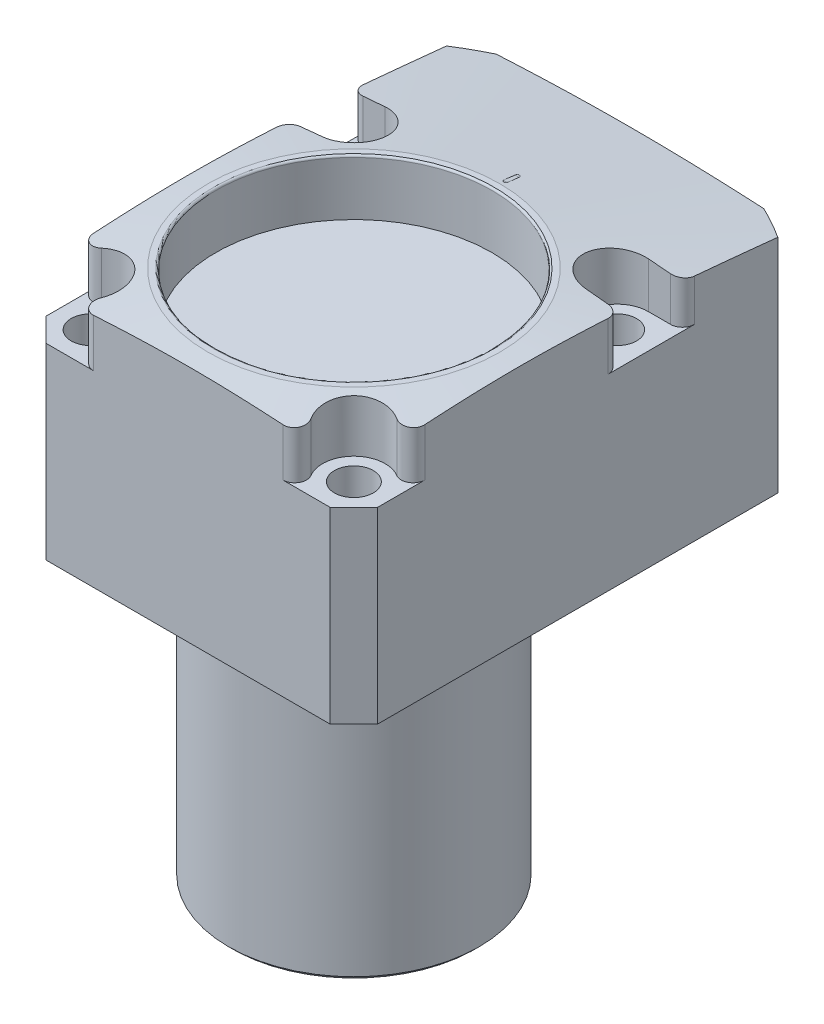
SolidWorks part; units mm, degrees
ref_plane "Front Plane" through (0, 0, 0) normal (0, 0, 1) x (1, 0, 0)
ref_plane "Top Plane" through (0, 0, 0) normal (0, 1, 0) x (1, 0, 0)
ref_plane "Right Plane" through (0, 0, 0) normal (1, 0, 0) x (0, 0, -1)
sketch "Sketch6" plane through (0, 0, 0) normal (0, 0, 1) x (1, 0, 0)
  line L0 (0, -8.9689) -> (0, 71.3762) construction
  line L1 (17.515, 30.5816) -> (18.5, 30.5816)
  line L2 (18.5, 30.5816) -> (38.895, 28.0774)
  line L3 (38.895, 28.0774) -> (38.895, 0)
  line L4 (38.895, 0) -> (15.885, 0)
  line L5 (15.885, 0) -> (15.885, -36.4998)
  line L6 (15.885, -36.4998) -> (0, -36.4998)
  line L7 (0, -36.4998) -> (0, 23.5116)
  line L8 (17.515, 30.5816) -> (17.515, 23.5116)
  line L9 (17.515, 23.5116) -> (0, 23.5116)
  dimension "D1" = 31.77
  dimension "D2" = 30.5816
  dimension "D3" = 36.4998
  dimension "D4" = 77.79
  dimension "D5" = 7
  dimension "D6" = 37
  dimension "D7" = 7.07
  dimension "D8" = 35.03
  dimension "D9" = 67.0814
revolve "Revolve3" add sketch "Sketch6" angle 360 about L0
fillet "Fillet7" radius 0.25 1 edges at (0, 30.5816, -17.515)
sketch "Sketch7" plane through (0, 0, 0) normal (0, -1, 0) x (1, 0, 0)
  line L0 (0, 0) -> (0, -52.3237) construction
  line L1 (-21, 21) -> (21, 21)
  line L2 (-21, 21) -> (-21, -35)
  line L3 (-21, -35) -> (21, -35)
  line L4 (21, 21) -> (21, -35)
  dimension "D1" = 42
  dimension "D2" = 56
  dimension "D3" = 21
extrude "Cut-Extrude5" cut sketch "Sketch7" against normal through all flip side to cut
sketch "Sketch8" plane through (0, 0, 0) normal (0, -1, 0) x (1, 0, 0)
  circle A0 centre (-16.6878, 16.6878) radius 2.4638
  dimension "D1" = 4.9276
  dimension "D2" = 16.6878
  dimension "D3" = 16.6878
extrude "Cut-Extrude6" cut sketch "Sketch8" against normal through all
pattern_circular "CirPattern2" count 4 over 360 about axis through (0, 0, 0) along (0, 1, 0) of "Cut-Extrude6"
chamfer "Chamfer1" distance 3 angle 45 2 edges at (-21, 14.6033, 21) (21, 14.6033, 21)
sketch "Sketch9" plane through (0, 30.5816, 0) normal (0, 1, 0) x (1, 0, 0)
  line L0 (-21, -18) -> (-18, -21) construction
  line L1 (-18, -21) -> (18, -21) construction
  line L2 (21, 20.6566) -> (21, 12.7191)
  line L3 (-21, -18) -> (-18, -21)
  line L4 (21, 12.7191) -> (16.6878, 12.7191)
  line L5 (16.6878, 20.6566) -> (21, 20.6566)
  line L6 (-16.6878, 20.6566) -> (-21, 20.6566)
  line L7 (-21, 32.7387) -> (-21, -18) construction
  line L8 (-21, 12.7191) -> (-16.6878, 12.7191)
  line L9 (-21, 20.6566) -> (-21, 12.7191)
  line L10 (-18, -21) -> (-15.3873, -21)
  line L11 (0, 0) -> (0, 26.6366) construction
  line L13 (-21, -15.3873) -> (-19.4941, -13.8815)
  line L14 (-13.8815, -19.4941) -> (-15.3873, -21)
  line L15 (-21, -15.3873) -> (-21, -18)
  line L16 (21, -15.3873) -> (21, -18)
  line L17 (13.8815, -19.4941) -> (15.3873, -21)
  line L18 (21, -15.3873) -> (19.4941, -13.8815)
  line L19 (18, -21) -> (15.3873, -21)
  line L20 (21, -18) -> (18, -21)
  arc A0 (-13.8815, -19.4941) -> (-19.4941, -13.8815) centre (-16.6878, -16.6878) ccw
  arc A1 (-16.6878, 12.7191) -> (-16.6878, 20.6566) centre (-16.6878, 16.6878) ccw
  arc A2 (13.8815, -19.4941) -> (19.4941, -13.8815) centre (16.6878, -16.6878) cw
  arc A3 (16.6878, 12.7191) -> (16.6878, 20.6566) centre (16.6878, 16.6878) cw
  dimension "D1" = 7.9375
extrude "Cut-Extrude7" cut sketch "Sketch9" against normal offset from surface (6.7818 mm away) 23.7998
fillet "Fillet4" radius 1.5 8 edges at (-21, 26.8192, -12.7191) (21, 26.518, -20.6566) (21, 26.8192, -12.7191) (21, 26.7282, 15.3873) (15.3873, 26.7282, 21) (-15.3873, 26.7282, 21) (-21, 26.7282, 15.3873) (-21, 26.518, -20.6566)
fillet "Fillet5" radius 0.4 1 edges at (0, 0, -15.885)
chamfer "Chamfer2" distance 0.5 angle 45 1 edges at (0, -36.4998, -15.885)
ref_plane "Plane1" through (0, 17.018, 0) normal (0, -1, 0) x (1, 0, 0)
sketch "Sketch11" plane through (0, 17.018, 0) normal (0, -1, 0) x (1, 0, 0)
  line L0 (-10, -4.7006) -> (-10, -58.3255) construction
  line L1 (-16.9653, -35) -> (16.9653, -35) construction
  line L2 (-16.1849, -34.75) -> (-15.6396, -32.1846)
  line L3 (-15.6396, -32.1846) -> (-14.9784, -31.5234)
  line L10 (-10, -35) -> (-20.4775, -35)
  line L11 (-10, -20.018) -> (-10, -35)
  line L12 (-14.9784, -20.018) -> (-10, -20.018)
  line L13 (-14.9784, -31.5234) -> (-14.9784, -20.018)
  line L15 (-20.4775, -34.75) -> (-16.1849, -34.75)
  line L16 (-20.4775, -35) -> (-20.4775, -34.75)
  dimension "D1" = 10
  dimension "D2" = 0.25
  dimension "D3" = 14.732
  dimension "D4" = 9.9568
  dimension "D5" = 20.955
  dimension "D6" = 12
  dimension "D7" = 12.3698
  dimension "D8" = 45
  dimension "D9" = 2.5654
revolve "Cut-Revolve5" cut sketch "Sketch11" angle 360 about L0
ref_plane "Plane2" through (0, 0, -26.7462) normal (0, 0, 1) x (1, 0, 0)
sketch "Sketch13" plane through (0, 0, -26.7462) normal (0, 0, 1) x (1, 0, 0)
  line L0 (-13.4544, 17.7546) -> (-13.4544, 5.5009)
  line L1 (-13.4544, 5.5009) -> (-14.1293, 4.826)
  line L2 (-14.572, 2.7432) -> (-15.6261, 2.7432)
  line L3 (-15.6261, 2.7432) -> (-15.6261, 0)
  line L4 (-16.285, 0) -> (16.285, 0) construction
  line L5 (-15.6261, 0) -> (-10, 0)
  line L6 (-10, 0) -> (-10, 17.7546)
  line L7 (-10, 17.7546) -> (-13.4544, 17.7546)
  line L8 (-10, 15.2099) -> (-10, -4.3918) construction
  line L9 (-14.572, 2.7432) -> (-14.1293, 4.826)
  line L10 (-14.572, 2.7432) -> (-10, 2.7432) construction
  dimension "D1" = 10
  dimension "D2" = 6.9088
  dimension "D3" = 15.0114
  dimension "D4" = 2.7432
  dimension "D5" = 11.2522
  dimension "D6" = 45
  dimension "D7" = 9.144
  dimension "D8" = 2.0828
  dimension "D9" = 12
revolve "Cut-Revolve6" cut sketch "Sketch13" angle 360 about L8
sketch "Sketch1" plane through (20.475, 11.3284, -26.7462) normal (0, 0, 1) x (1, 0, 0)
  line L0 (-30.475, 0) -> (-30.475, 50000) construction
  line L1 (-28.8875, -3.175) -> (-26.6015, -3.175)
  line L2 (-26.6015, -3.175) -> (-26.6015, -6.0714)
  line L3 (-26.5634, -8.5852) -> (50000, -8.5852) construction
  line L4 (-27.4778, -6.985) -> (-27.4778, -7.6708)
  line L5 (-26.5634, -8.5852) -> (-25.014, -8.5852)
  line L6 (-25.014, -8.5852) -> (-25.014, -10.0076)
  line L7 (-25.014, -10.0076) -> (-25.692, -10.0076)
  line L8 (-27.808, -10.0076) -> (-27.808, -11.1252)
  line L9 (-27.808, -11.1252) -> (-28.8875, -11.1252)
  line L10 (-28.8875, -11.1252) -> (-28.8875, -3.175)
  line L11 (-1000, -8.5852) -> (-28.8875, -8.5852) construction
  line L12 (-26.114, -10.0076) -> (-27.808, -10.0076)
  arc A0 (-26.6015, -6.0714) -> (-27.4778, -6.985) centre (-26.5634, -6.985) ccw
  arc A1 (-27.4778, -7.6708) -> (-26.5634, -8.5852) centre (-26.5634, -7.6708) ccw
  arc A2 (-26.114, -10.0076) -> (-25.692, -10.0076) centre (-25.903, -10.8712) ccw
  dimension "D8" = 1.6002
  dimension "D9" = 0.9144
  dimension "D10" = 7.9502
  dimension "D11" = 1.778
  dimension "D1" = 7.747
  dimension "D2" = 5.9944
  dimension "D3" = 10.922
  dimension "D4" = 5.334
  dimension "D5" = 3.175
  dimension "D6" = 1.4224
  dimension "D7" = 2.54
  dimension "D12" = 0.8636
revolve "Revolve1" add sketch "Sketch1" angle 360 about L0
sketch "Sketch2" plane through (-27.5235, 0.2032, -26.7462) normal (0, -1, 0) x (0, 0, 1)
  line L0 (0, 0) -> (0, 50000) construction
  line L1 (0, -15.6904) -> (1.5875, -16.607)
  line L2 (1.5875, -16.607) -> (1.5875, -18.44)
  line L3 (1.5875, -18.44) -> (0, -19.3566)
  line L4 (0, -19.3566) -> (-1.5875, -18.44)
  line L5 (-1.5875, -18.44) -> (-1.5875, -16.607)
  line L6 (-1.5875, -16.607) -> (0, -15.6904)
  circle A0 centre (0, -17.5235) radius 1.5875 construction
  dimension "D1" = 3.175
extrude "Cut-Extrude1" cut sketch "Sketch2" against normal up to surface (7.9502 mm away)
other "PORT_ADTAPTER<1>"
sketch "Sketch17" plane through (0, 0, 0) normal (1, 0, 0) x (0, 0, -1)
  line L0 (18.5428, 31.3421) -> (21.6201, 30.9642)
  line L7 (35, 28.5557) -> (18.5, 30.5816) construction
  line L16 (14.3637, 31.8552) -> (30.0966, 29.9234) construction
  line L18 (19.3368, 31.2446) -> (20.826, 31.0617) construction
  line L20 (19.2393, 30.4505) -> (20.7286, 30.2677)
  line L21 (35, 28.5557) -> (18.5, 30.5816) construction
  line L22 (18.9963, 30.5207) -> (20.9814, 30.2769) construction
  arc A0 (18.5428, 31.3421) -> (19.2393, 30.4505) centre (19.3368, 31.2446) ccw
  arc A1 (20.7286, 30.2677) -> (21.6201, 30.9642) centre (20.826, 31.0617) ccw
  point P4 (20.0814, 30.1415)
  dimension "D1" = 0.8
  dimension "D5" = 1.6
  dimension "D2" = 0.76
  dimension "D3" = 2
  dimension "D4" = 0.5
ref_plane "Plane3" through (0.0052, 28.5557, -35) normal (0, 0.9925, -0.1219) x (-1, 0, 0)
revolve "ZERO_MARK_INDICATOR" cut sketch "Sketch17" angle 360 about L16
